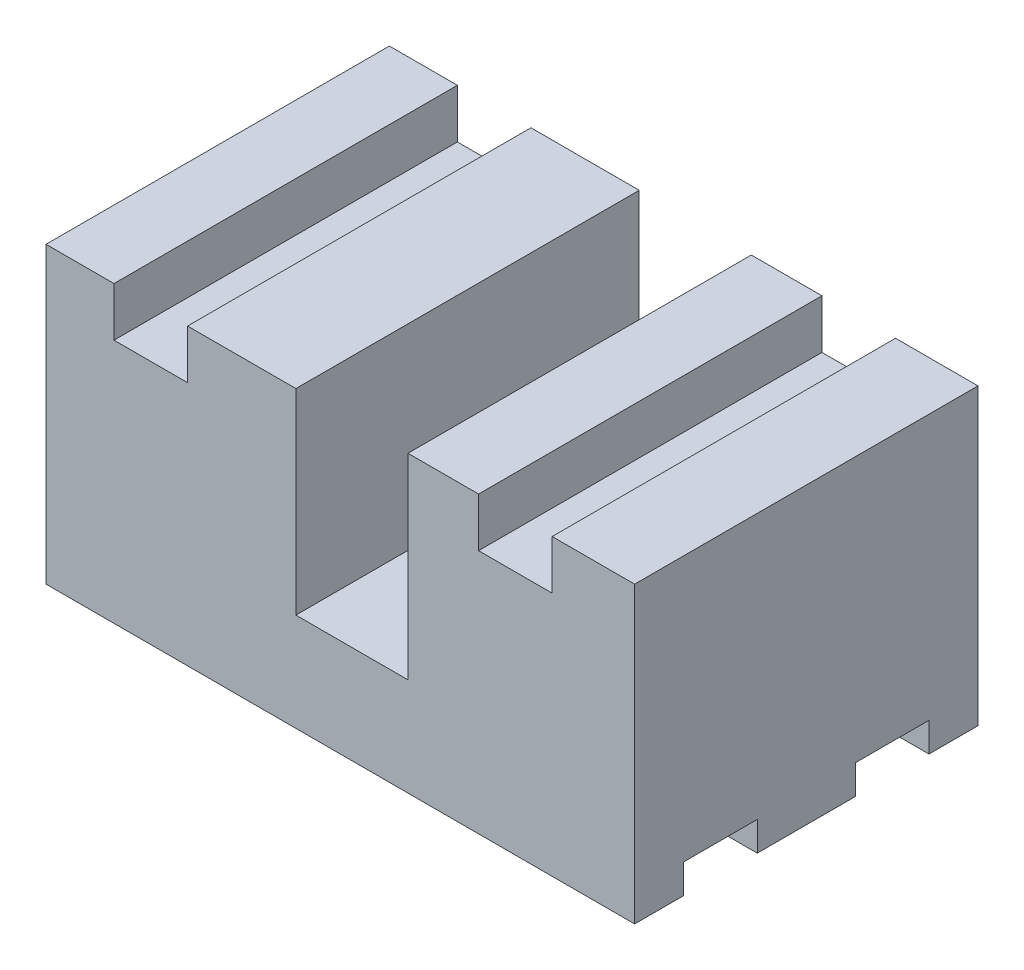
SolidWorks part; units mm, degrees
ref_plane "Front Plane" through (0, 0, 0) normal (0, 0, 1) x (1, 0, 0)
ref_plane "Top Plane" through (0, 0, 0) normal (0, 1, 0) x (1, 0, 0)
ref_plane "Right Plane" through (0, 0, 0) normal (1, 0, 0) x (0, 0, -1)
sketch "Sketch1" plane through (0, 0, 0) normal (1, 0, 0) x (0, 0, -1)
  line L0 (0, 50) -> (0, 0)
  line L1 (0, 0) -> (25, 0)
  line L2 (25, 0) -> (25, 14.8994)
  line L3 (25, 14.8994) -> (62.5, 14.8994)
  line L4 (62.5, 14.8994) -> (62.5, 0)
  line L5 (62.5, 0) -> (112.5, 0)
  line L6 (112.5, 0) -> (112.5, 14.8994)
  line L7 (112.5, 14.8994) -> (150, 14.8994)
  line L8 (150, 14.8994) -> (150, 0)
  line L9 (150, 0) -> (175, 0)
  line L10 (175, 0) -> (175, 50)
  line L11 (175, 50) -> (0, 50)
  dimension "D1" = 50
  dimension "D2" = 175
  dimension "D3" = 25
  dimension "D4" = 14.8994
extrude "Boss-Extrude1" add sketch "Sketch1" along normal blind 300
sketch "Sketch2" plane through (0, 0, 0) normal (0, 0, 1) x (1, 0, 0)
  line L0 (0, 50) -> (0, 150)
  line L1 (0, 150) -> (34.6566, 150)
  line L2 (34.6566, 150) -> (34.6566, 125)
  line L3 (34.6566, 125) -> (72.1566, 125)
  line L4 (72.1566, 125) -> (72.1566, 150)
  line L5 (72.1566, 150) -> (127.3527, 150)
  line L6 (127.3527, 150) -> (127.3527, 50)
  line L7 (300, 50) -> (0, 50) construction
  line L8 (127.3527, 50) -> (0, 50)
  line L10 (300, 50) -> (300, 150)
  line L11 (300, 150) -> (257.9659, 150)
  line L12 (257.9659, 150) -> (257.9659, 125)
  line L13 (257.9659, 125) -> (220.4659, 125)
  line L14 (220.4659, 125) -> (220.4659, 150)
  line L15 (220.4659, 150) -> (184.4717, 150)
  line L16 (184.4717, 150) -> (184.4717, 50)
  line L17 (184.4717, 50) -> (300, 50)
  dimension "D1" = 100
  dimension "D2" = 25
  dimension "D3" = 57.1191
extrude "Boss-Extrude2" add sketch "Sketch2" against normal up to vertex (175 mm away)
